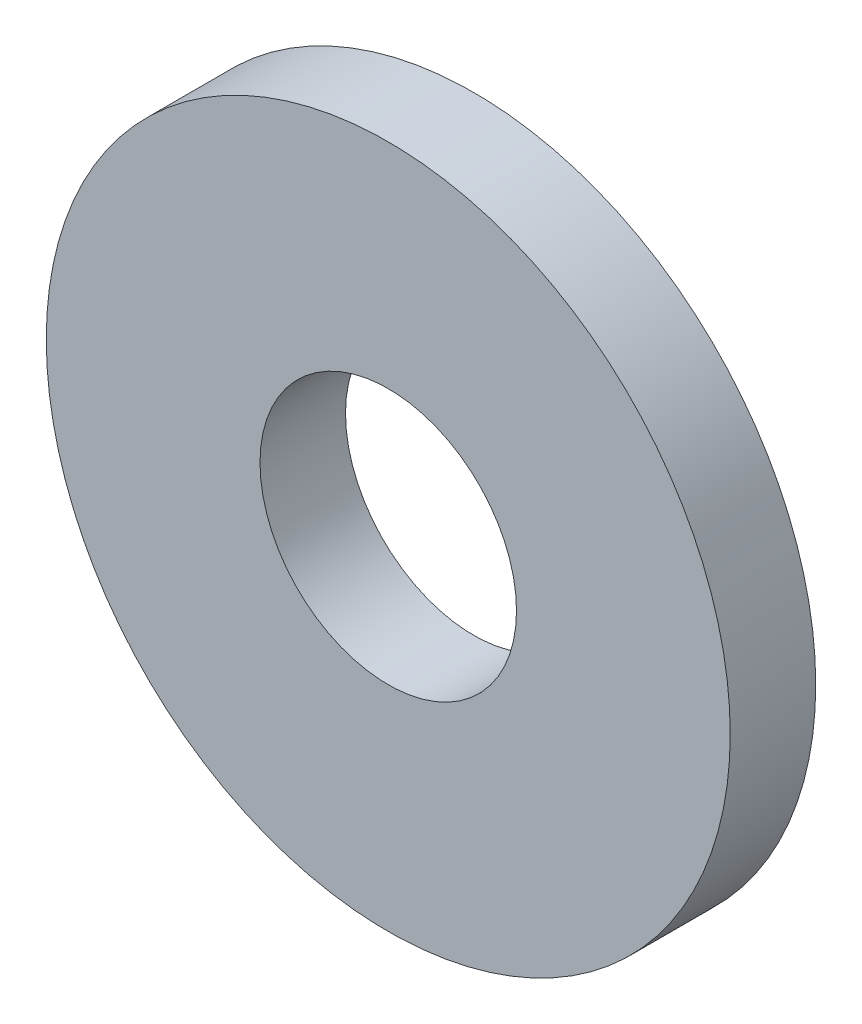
SolidWorks part; units mm, degrees
ref_plane "Face" through (0, 0, 0) normal (0, 0, 1) x (1, 0, 0)
ref_plane "Dessus" through (0, 0, 0) normal (0, 1, 0) x (1, 0, 0)
ref_plane "Droite" through (0, 0, 0) normal (1, 0, 0) x (0, 0, -1)
sketch "Esquisse1" plane through (0, 0, 0) normal (0, 0, 1) x (1, 0, 0)
  circle A0 centre (0, 0) radius 4
  circle A1 centre (0, 0) radius 1.5
  dimension "D1" = 8
  dimension "D2" = 3
extrude "Base-Extrusion" add sketch "Esquisse1" along normal blind 1
